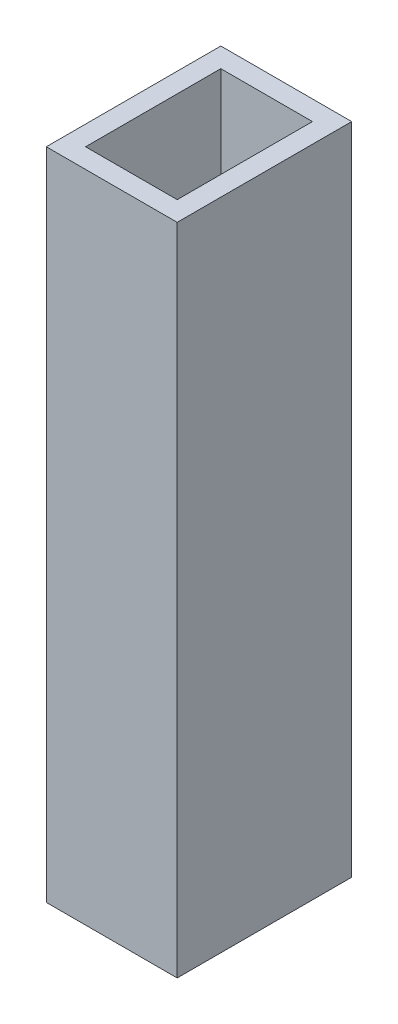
SolidWorks part; units mm, degrees
ref_plane "Front Plane" through (0, 0, 0) normal (0, 0, 1) x (1, 0, 0)
ref_plane "Top Plane" through (0, 0, 0) normal (0, 1, 0) x (1, 0, 0)
ref_plane "Right Plane" through (0, 0, 0) normal (1, 0, 0) x (0, 0, -1)
sketch "Sketch2" plane through (0, 0, 0) normal (0, 1, 0) x (1, 0, 0)
  line L1 (0, 0) -> (-76.2, 0)
  line L2 (0, 0) -> (0, 101.6)
  line L3 (0, 101.6) -> (-76.2, 101.6)
  line L4 (-76.2, 0) -> (-76.2, 101.6)
  dimension "D1" = 76.2
  dimension "D2" = 101.6
extrude "Extrude1" add sketch "Sketch2" along normal blind 381
sketch "Sketch8" plane through (0, 381, 0) normal (0, 1, 0) x (-1, 0, 0)
  line L8 (11.43, -11.43) -> (11.43, -90.17)
  line L9 (11.43, -90.17) -> (64.77, -90.17)
  line L10 (64.77, -90.17) -> (64.77, -11.43)
  line L11 (64.77, -11.43) -> (11.43, -11.43)
  line L12 (11.43, -11.43) -> (11.43, -90.17)
  line L13 (11.43, -90.17) -> (64.77, -90.17)
  line L14 (64.77, -90.17) -> (64.77, -11.43)
  line L15 (64.77, -11.43) -> (11.43, -11.43)
  dimension "D1" = 11.43
extrude "Cut-Extrude2" cut sketch "Sketch8" against normal blind 134.62
